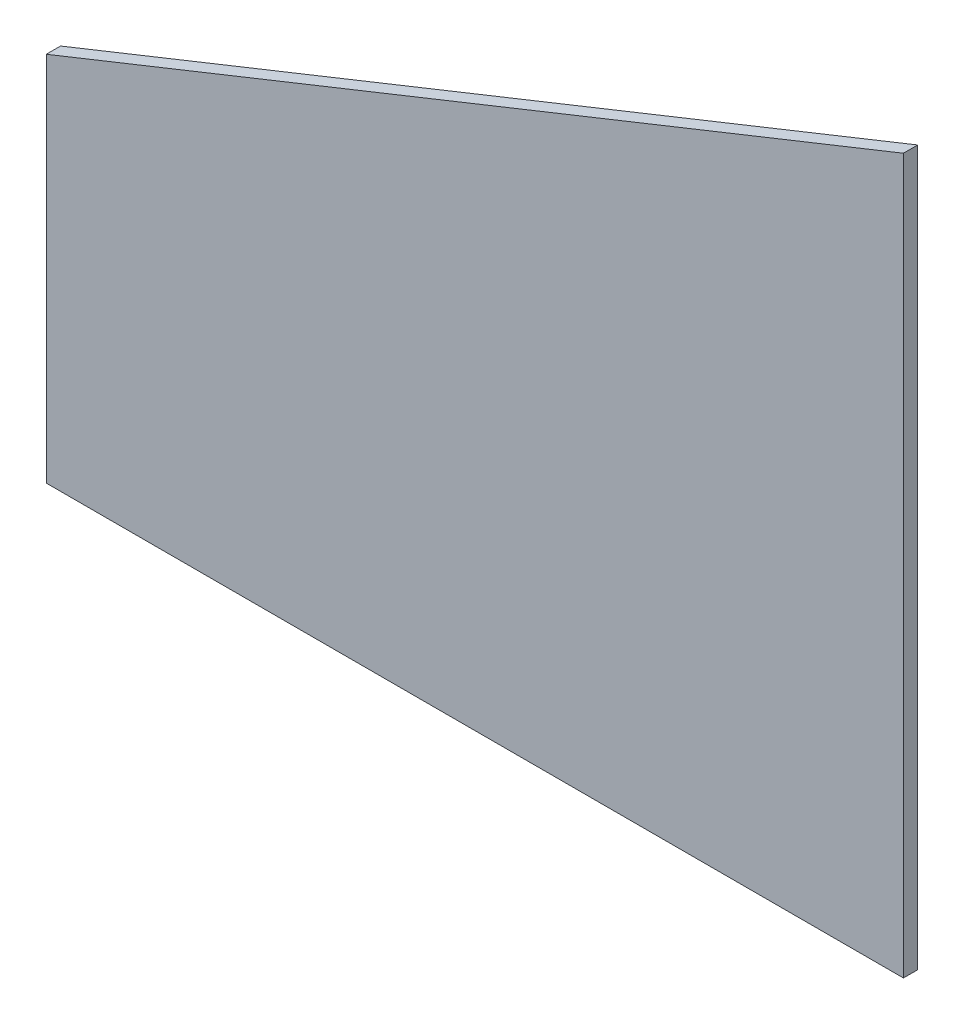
SolidWorks part; units mm, degrees
ref_plane "Front Plane" through (0, 0, 0) normal (1, 0, 0) x (0, 1, 0)
ref_plane "Top Plane" through (0, 0, 0) normal (0, 0, 1) x (0, 1, 0)
ref_plane "Right Plane" through (0, 0, 0) normal (0, 1, 0) x (-1, 0, 0)
sketch "Sketch1" plane through (0, 0, 0) normal (1, 0, 0) x (0, 1, 0)
  line L1 (-82.55, -82.55) -> (82.55, -82.55)
  line L2 (-82.55, -82.55) -> (-82.55, -76.2)
  line L3 (-82.55, -76.2) -> (82.55, -76.2)
  line L4 (82.55, -82.55) -> (82.55, -76.2)
ref_plane "Plane1" through (304.8, 0, 0) normal (1, 0, 0) x (0, 1, 0)
sketch "Sketch2" plane through (304.8, 0, 0) normal (1, 0, 0) x (0, 1, 0)
  line L1 (-158.75, -158.75) -> (158.75, -158.75)
  line L2 (-158.75, -158.75) -> (-158.75, -152.4)
  line L3 (-158.75, -152.4) -> (158.75, -152.4)
  line L4 (158.75, -158.75) -> (158.75, -152.4)
loft "Tapered_plywood_panel" add profiles "Sketch1", "Sketch2"
